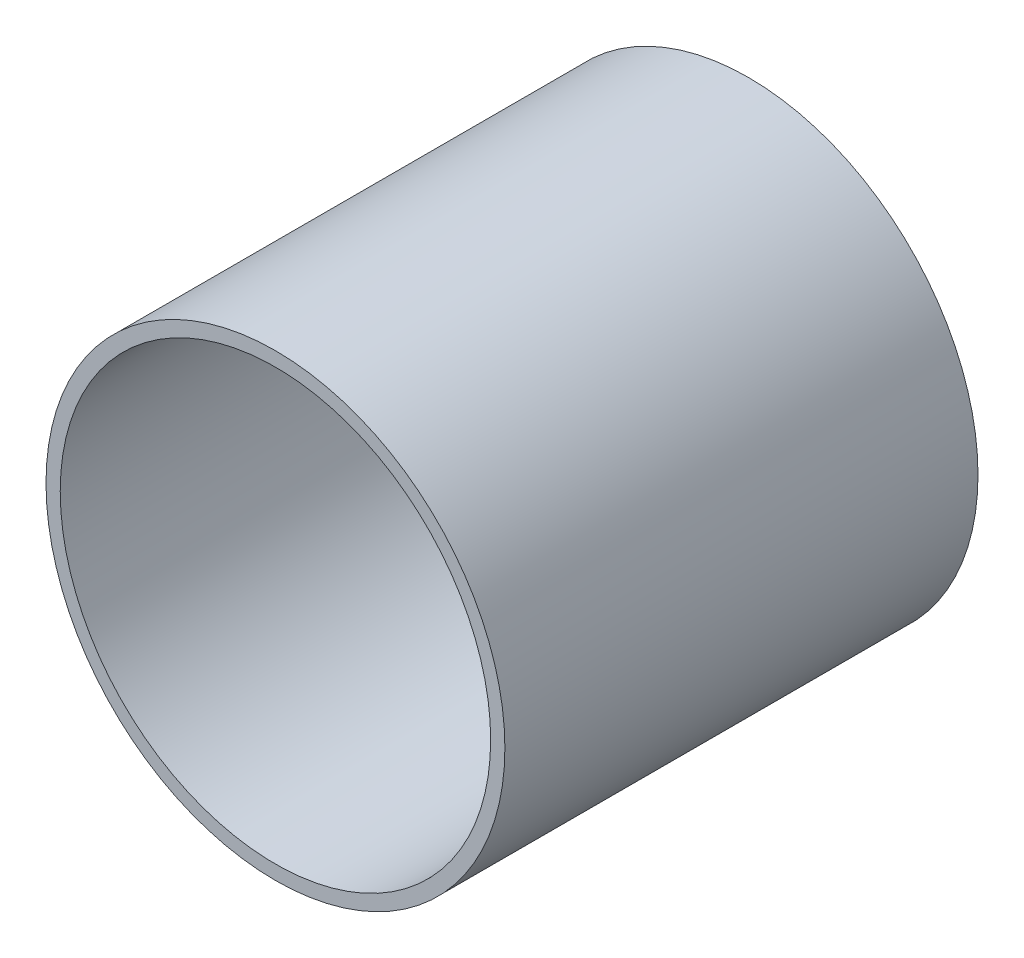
SolidWorks part; units mm, degrees
ref_plane "Front Plane" through (0, 0, 0) normal (0, 0, 1) x (1, 0, 0)
ref_plane "Top Plane" through (0, 0, 0) normal (0, 1, 0) x (1, 0, 0)
ref_plane "Right Plane" through (0, 0, 0) normal (1, 0, 0) x (0, 0, -1)
sketch "Sketch1" plane through (0, 0, 0) normal (0, 0, 1) x (1, 0, 0)
  circle A0 centre (0, 0) radius 25.4
  dimension "D1" = 50.8
extrude "end" add sketch "Sketch1" along normal blind 1.5748
sketch "Sketch2" plane through (0, 0, 1.5748) normal (0, 0, 1) x (1, 0, 0)
  circle A0 centre (0, 0) radius 25.4 construction
  circle A1 centre (0, 0) radius 25.4
  circle A2 centre (0, 0) radius 23.8252
  dimension "D1" = 1.5748
extrude "body" add sketch "Sketch2" along normal blind 50.8
